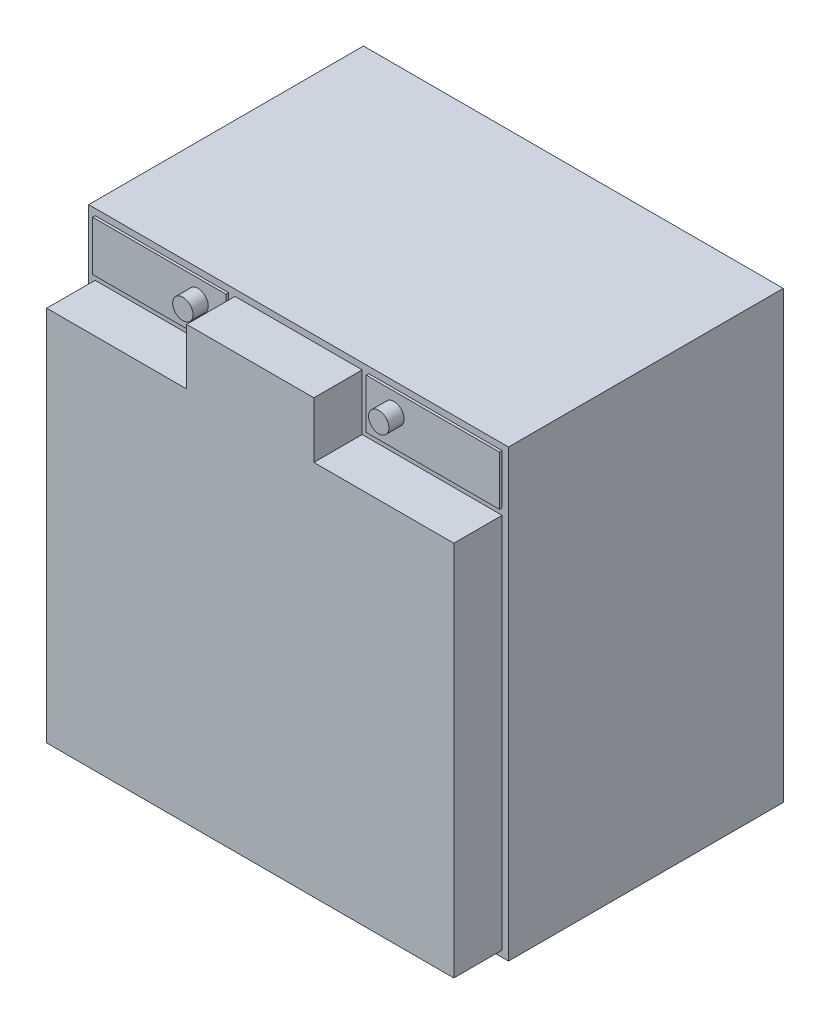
SolidWorks part; units mm, degrees
ref_plane "Face" through (0, 0, 0) normal (0, 0, 1) x (1, 0, 0)
ref_plane "Dessus" through (0, 0, 0) normal (0, 1, 0) x (1, 0, 0)
ref_plane "Droite" through (0, 0, 0) normal (1, 0, 0) x (0, 0, -1)
sketch "Esquisse1" plane through (0, 0, 0) normal (0, 1, 0) x (1, 0, 0)
  line L1 (0, 0) -> (165, 0)
  line L2 (0, 0) -> (0, 108)
  line L3 (0, 108) -> (165, 108)
  line L4 (165, 0) -> (165, 108)
  dimension "D1" = 108
  dimension "D2" = 165
extrude "Extrusion1" add sketch "Esquisse1" along normal blind 175
sketch "Esquisse2" plane through (0, 0, 0) normal (0, 0, 1) x (1, 0, 0)
  line L0 (2.5, 150.5) -> (2.5, 2.5)
  line L1 (2.5, 2.5) -> (162.5, 2.5)
  line L2 (162.5, 2.5) -> (162.5, 150.5)
  line L3 (162.5, 150.5) -> (107.5, 150.5)
  line L4 (107.5, 150.5) -> (107.5, 172.5)
  line L5 (107.5, 172.5) -> (57.5, 172.5)
  line L6 (57.5, 172.5) -> (57.5, 150.5)
  line L7 (57.5, 150.5) -> (2.5, 150.5)
  line L8 (0, 175) -> (0, 0) construction
  line L10 (0, 175) -> (165, 175) construction
  line L11 (0, 0) -> (165, 0) construction
  dimension "D1" = 50
  dimension "D2" = 55
  dimension "D3" = 55
  dimension "D4" = 2.5
  dimension "D5" = 2.5
  dimension "D6" = 2.5
  dimension "D7" = 22
  dimension "D8" = 22
extrude "Extrusion2" add sketch "Esquisse2" along normal blind 19
sketch "Esquisse4" plane through (0, 0, 0) normal (0, 0, 1) x (1, 0, 0)
  line L1 (2.5, 172.5) -> (55, 172.5)
  line L2 (2.5, 172.5) -> (2.5, 153)
  line L3 (2.5, 153) -> (55, 153)
  line L4 (55, 172.5) -> (55, 153)
  line L5 (0, 175) -> (165, 175) construction
  line L6 (0, 175) -> (0, 0) construction
  line L7 (57.5, 172.5) -> (57.5, 150.5) construction
  line L8 (57.5, 150.5) -> (2.5, 150.5) construction
  dimension "D1" = 2.5
  dimension "D2" = 2.5
  dimension "D3" = 2.5
  dimension "D4" = 2.5
extrude "Extrusion3" add sketch "Esquisse4" along normal blind 1
sketch "Esquisse5" plane through (0, 0, 0) normal (0, 0, 1) x (1, 0, 0)
  line L0 (0, 175) -> (165, 175) construction
  line L1 (110.08, 172.5) -> (162.5, 172.5)
  line L2 (110.08, 172.5) -> (110.08, 153)
  line L3 (110.08, 153) -> (162.5, 153)
  line L4 (162.5, 172.5) -> (162.5, 153)
  line L5 (165, 175) -> (165, 0) construction
  line L6 (162.5, 150.5) -> (107.5, 150.5) construction
  line L7 (107.5, 150.5) -> (107.5, 172.5) construction
  dimension "D1" = 2.5
  dimension "D2" = 2.5
  dimension "D3" = 2.5
  dimension "D4" = 2.58
extrude "Extrusion4" add sketch "Esquisse5" along normal blind 1
sketch "Esquisse6" plane through (0, 0, 1) normal (0, 0, 1) x (1, 0, 0)
  line L1 (0, 175) -> (165, 175) construction
  line L2 (0, 175) -> (0, 0) construction
  line L3 (165, 175) -> (165, 0) construction
  circle A0 centre (44, 165) radius 4
  circle A1 centre (121, 165) radius 4
  dimension "D3" = 44
  dimension "D1" = 10
  dimension "D2" = 44
extrude "Extrusion5" add sketch "Esquisse6" along normal blind 6
